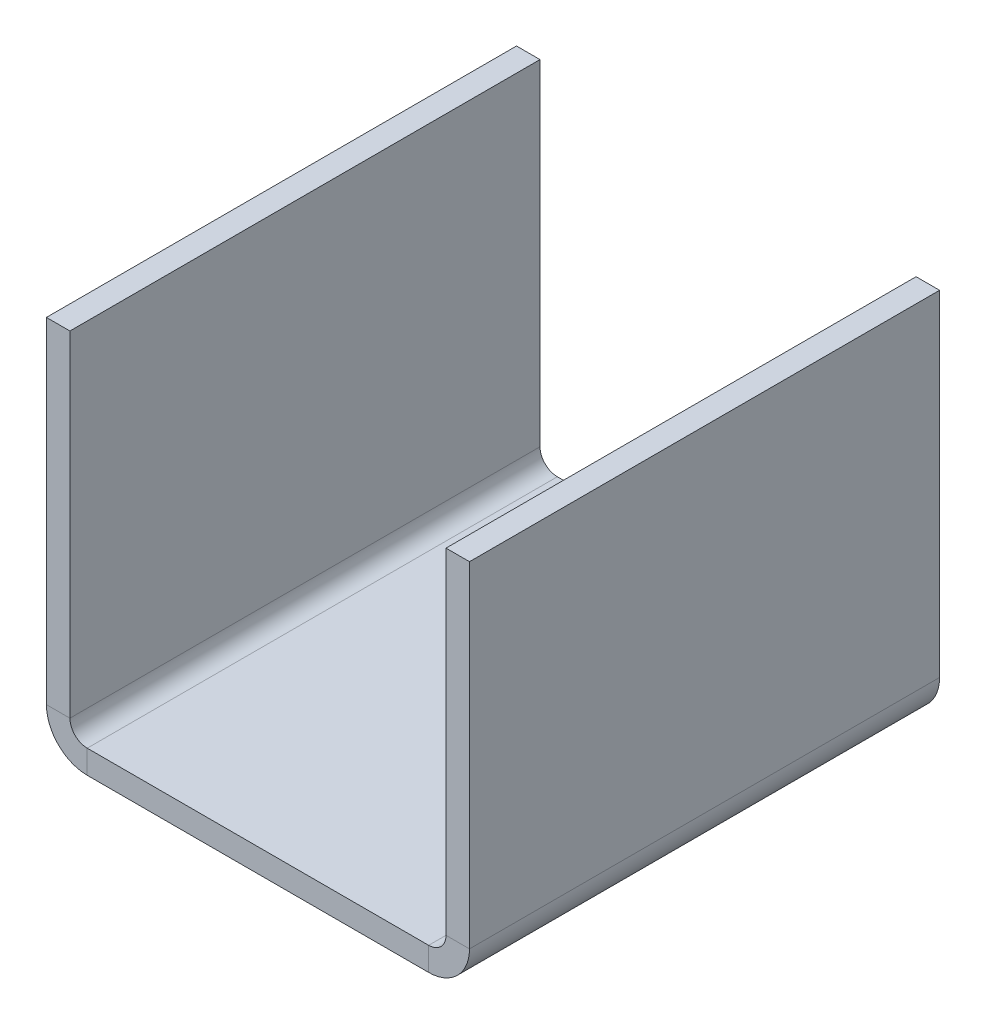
SolidWorks part; units mm, degrees
ref_plane "Front" through (0, 0, 0) normal (0, 0, 1) x (1, 0, 0)
ref_plane "Top" through (0, 0, 0) normal (0, 1, 0) x (1, 0, 0)
ref_plane "Right" through (0, 0, 0) normal (1, 0, 0) x (0, 0, -1)
sketch "Sketch1" plane through (0, 0, 0) normal (0, 1, 0) x (1, 0, 0)
  line L1 (0, 0) -> (50, 0)
  line L2 (0, 0) -> (0, 20)
  line L3 (0, 20) -> (50, 20)
  line L4 (50, 0) -> (50, 20)
sheet metal parameters "Sheet-Metal1" thickness 1 parameters "D1"=0.7366
base flange "Base-Flange1" sketch "Sketch1" thickness 1 reverse thickness direction yes parameters "D1"=0.7366
sketch "Sketch3" plane through (0, 1, 0) normal (0, 1, 0) x (-1, 0, 0)
  line L2 (-16, 0) -> (-16, -20)
  line L3 (-34, 0) -> (-34, -20)
sketched bend "Sketched Bend2" parameters "D1"=0
bend "SketchBend3" bend radius 0.7366 bend angle 90 parameters "D5"=1
bend "SketchBend4" bend radius 0 bend angle 90 parameters "D5"=2
sketch "Sketch4" plane through (0, 18.4732, 0) normal (0, 1, 0) x (-1, 0, 0)
  line L0 (-16, 0) -> (-16, -20)
  line L1 (-16, -20) -> (-17, -20)
  line L2 (-17, -20) -> (-17, 0)
  line L3 (-17, 0) -> (-16, 0)
  line L4 (-33, 0) -> (-34, 0)
  line L5 (-34, 0) -> (-34, -20)
  line L6 (-34, -20) -> (-33, -20)
  line L7 (-33, -20) -> (-33, 0)
extrude "Cut-Extrude1" cut sketch "Sketch4" against normal blind 2.47
flat pattern "Flat-Pattern1"
sketch "Bend-Lines1" plane through (0, 0, 0) normal (0, 1, 0) x (-1, 0, 0)
bend of the flat pattern "Flatten-<SketchBend3>1"
bend of the flat pattern "Flatten-<SketchBend4>1"
